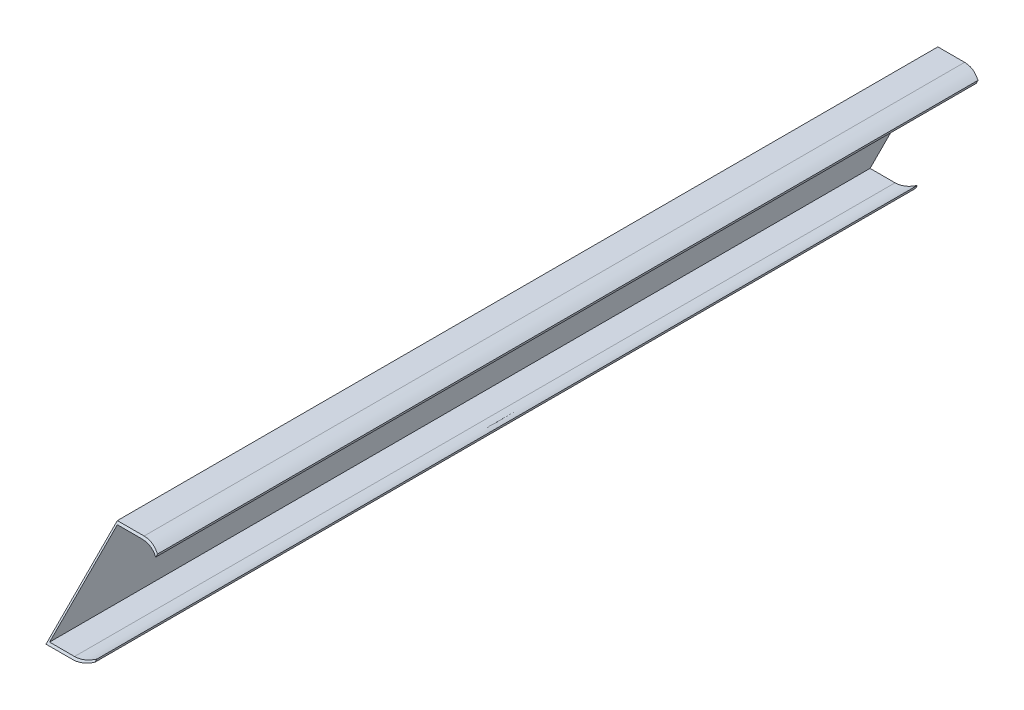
SolidWorks part; units mm, degrees
ref_plane "Plan de face" through (0, 0, 0) normal (0, 0, 1) x (1, 0, 0)
ref_plane "Plan de dessus" through (0, 0, 0) normal (0, 1, 0) x (1, 0, 0)
ref_plane "Plan de droite" through (0, 0, 0) normal (1, 0, 0) x (0, 0, -1)
sketch "Esquisse1" plane through (0, 0, 0) normal (0, 0, 1) x (1, 0, 0)
  line L0 (0, 0) -> (0, 80)
  line L1 (0, 80) -> (30, 80)
  line L2 (0, 40) -> (81.0721, 40) construction
  line L3 (2, 78) -> (2, 2)
  line L4 (0, 0) -> (30, 0)
  line L5 (2, 78) -> (30, 78)
  line L6 (50, 75) -> (50, 73)
  line L7 (50, 5) -> (50, 7)
  line L8 (2, 2) -> (30, 2)
  spline S0 degree 2 poles (30, 80) (40.6033, 79.9515) (50, 75) knots 0 0 0 1 1 1
  spline S1 degree 2 poles (30, 0) (40.6033, 0.0485) (50, 5) knots 0 0 0 1 1 1
  spline S2 degree 2 poles (30, 78) (40.6033, 77.9515) (50, 73) knots 0 0 0 1 1 1
  spline S3 degree 2 poles (30, 2) (40.6033, 2.0485) (50, 7) knots 0 0 0 1 1 1
  point P20 (2, 40)
  dimension "D1" = 80
  dimension "D2" = 30
  dimension "D3" = 5
  dimension "D4" = 50
  dimension "D5" = 1.2
  dimension "D6" = 10
  dimension "D7" = 5
  dimension "D8" = 10
  dimension "D9" = 1.2
  dimension "D10" = 28
  dimension "D11" = 20
  dimension "D12" = 2
  dimension "D13" = 2
extrude "Extrusion1" add sketch "Esquisse1" along normal blind 1000
sketch "Esquisse4" plane through (0, 0, 0) normal (-1, 0, 0) x (0, 0, 1)
  line L0 (1000, 0) -> (920, 80)
  line L2 (1000, 80) -> (0, 80) construction
  line L3 (1000, 0) -> (1000, 80)
  line L4 (920, 80) -> (1000, 80)
  line L5 (0, 80) -> (0, 0)
  line L6 (0, 0) -> (80, 0)
  line L7 (1000, 0) -> (0, 0) construction
  line L8 (80, 0) -> (0, 80)
  dimension "D1" = 45
  dimension "D2" = 45
extrude "Extrusion5" cut sketch "Esquisse4" against normal up to next
